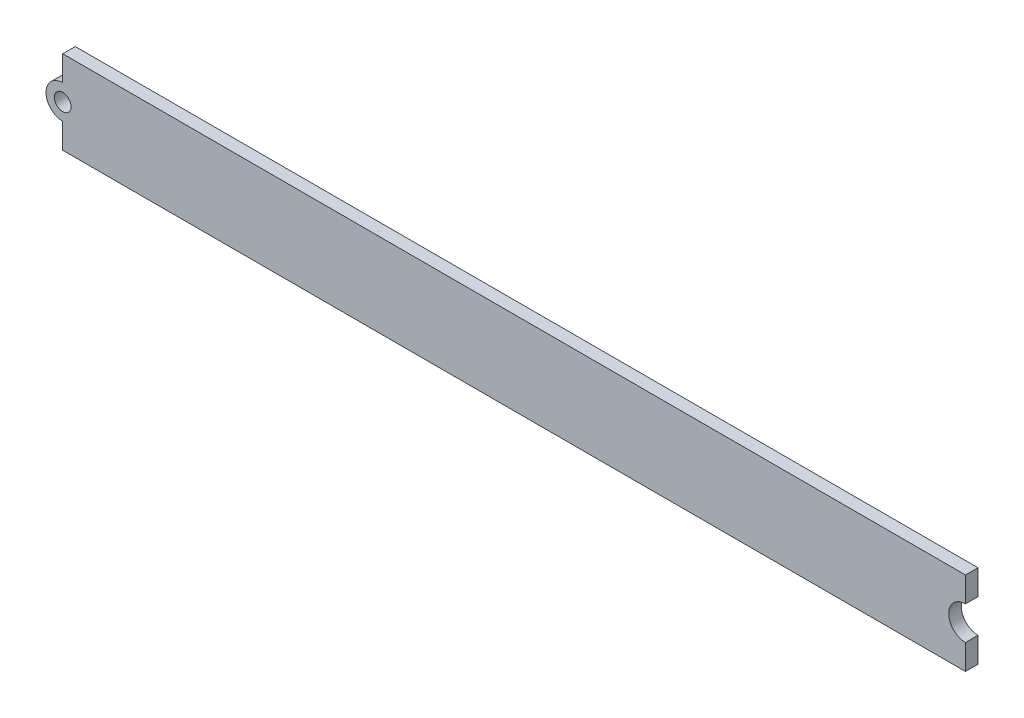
SolidWorks part; units mm, degrees
ref_plane "Plan de face" through (0, 0, 0) normal (0, 0, 1) x (1, 0, 0)
ref_plane "Plan de dessus" through (0, 0, 0) normal (0, 1, 0) x (1, 0, 0)
ref_plane "Plan de droite" through (0, 0, 0) normal (1, 0, 0) x (0, 0, -1)
sketch "Esquisse1" plane through (0, 0, 0) normal (0, 0, 1) x (1, 0, 0)
  line L0 (-50.5098, 0) -> (56.3137, 0) construction
  line L1 (0, 17.8039) -> (0, -14.1961) construction
  line L2 (-54, -2) -> (-54, -5)
  line L3 (-54, 5) -> (54, 5)
  line L4 (-54, 5) -> (-54, 2)
  line L5 (-54, -5) -> (54, -5)
  line L6 (54, 5) -> (54, 2)
  line L7 (54, -2) -> (54, -5)
  arc A0 (-54, 2) -> (-54, -2) centre (-54, 0) ccw
  circle A1 centre (-54, 0) radius 1
  arc A2 (54, 2) -> (54, -2) centre (54, 0) ccw
  dimension "D3" = 4
  dimension "D4" = 2
  dimension "D5" = 4
  dimension "D1" = 108
  dimension "D2" = 10
extrude "Boss.-Extru.1" add sketch "Esquisse1" along normal blind 1.5
